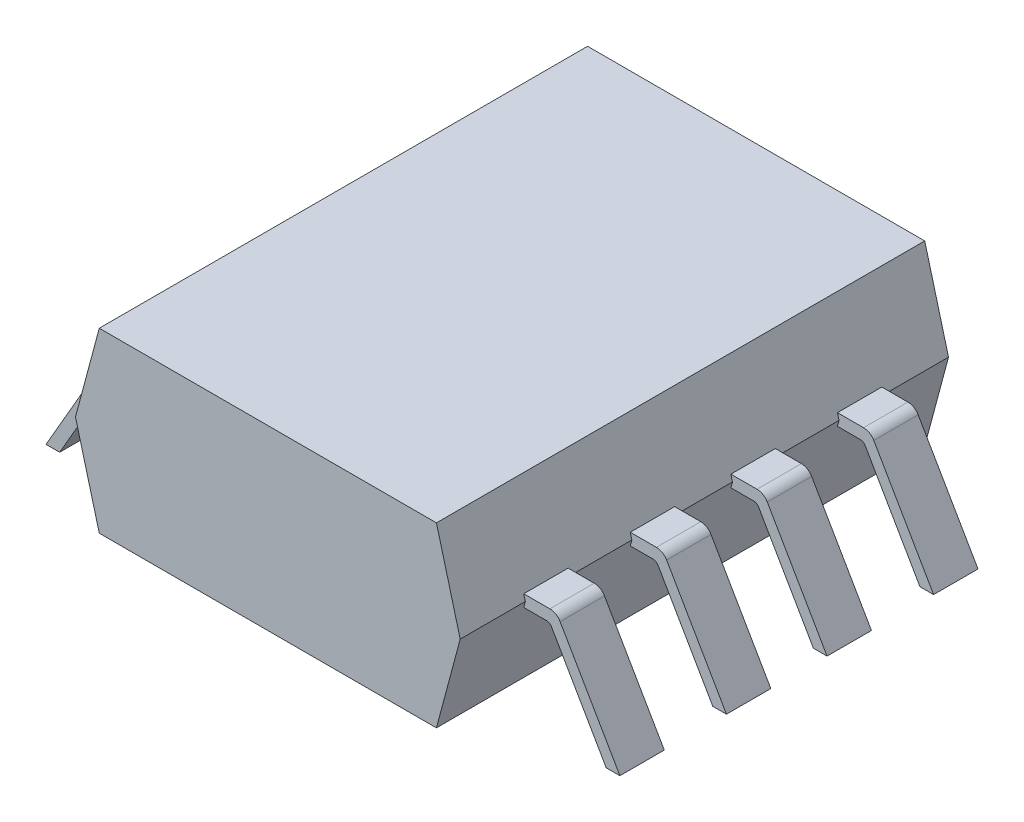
SolidWorks part; units mm, degrees
ref_plane "Front Plane" through (0, 0, 0) normal (0, 0, 1) x (1, 0, 0)
ref_plane "Top Plane" through (0, 0, 0) normal (0, 1, 0) x (1, 0, 0)
ref_plane "Right Plane" through (0, 0, 0) normal (1, 0, 0) x (0, 0, -1)
body saved out of another part "Stock-PSU-1"
pattern_linear "LPattern1" count 2 spacing 3.5 along (0, 0, 1)
combine bodies "Combine1" operation type add bodies to combine 102 101
